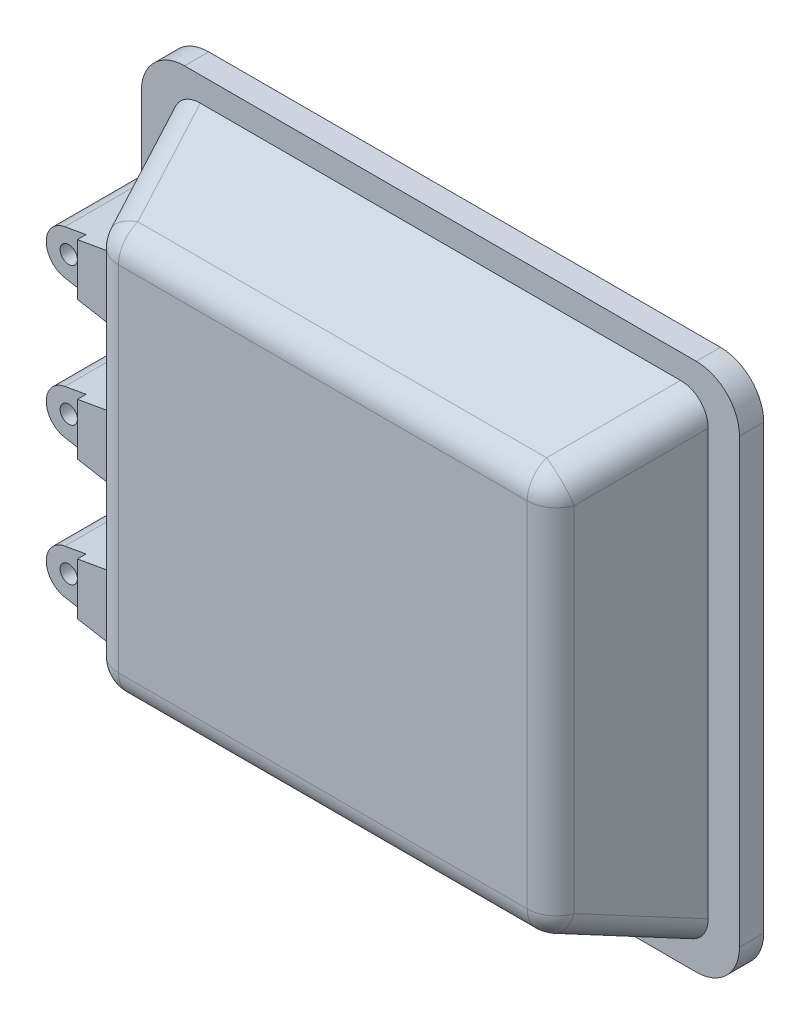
SolidWorks part; units mm, degrees
ref_plane "Ebene vorne" through (0, 0, 0) normal (0, 0, 1) x (1, 0, 0)
ref_plane "Ebene oben" through (0, 0, 0) normal (0, 1, 0) x (1, 0, 0)
ref_plane "Ebene rechts" through (0, 0, 0) normal (1, 0, 0) x (0, 0, -1)
sketch "Geometrieskizze" plane through (0, 0, 0) normal (0, 0, 1) x (1, 0, 0)
  line L0 (-145, 0) -> (145, 0) construction
  line L1 (-145, 129) -> (145, 129)
  line L2 (-145, 129) -> (-145, -129)
  line L3 (-145, -129) -> (145, -129)
  line L4 (145, 129) -> (145, -129)
  line L5 (0, 129) -> (0, -129) construction
  line L6 (-173, 153) -> (173, 153)
  line L7 (173, 153) -> (173, -153)
  line L8 (-173, -153) -> (173, -153)
  line L9 (-173, 153) -> (-173, -153)
  line L10 (0, 153) -> (0, 129) construction
  line L11 (145, 0) -> (173, 0) construction
  line L12 (0, -129) -> (0, -153) construction
  line L13 (-145, 0) -> (-173, 0) construction
  line L14 (-160, -142) -> (160, 142) construction
  line L15 (-160, 142) -> (160, 142) construction
  line L16 (-160, 142) -> (-160, -142) construction
  line L17 (-160, -142) -> (160, -142) construction
  line L18 (160, 142) -> (160, -142) construction
  point P8 (0, 0)
  point P22 (0, 0)
  dimension "D1" = 290
  dimension "D2" = 258
  dimension "D4" = 346
  dimension "D5" = 306
  dimension "D3" = 284
  dimension "D6" = 320
sketch "Skizze4" plane through (0, 0, 0) normal (0, 0, 1) x (1, 0, 0)
  line L4 (-145, 129) -> (145, 129) construction
  line L5 (145, 129) -> (145, -129) construction
  line L6 (-145, -129) -> (145, -129) construction
  line L7 (-145, 129) -> (-145, -129) construction
  line L8 (-145, 129) -> (145, 129)
  line L9 (145, 129) -> (145, -129)
  line L10 (-145, -129) -> (145, -129)
  line L11 (-145, 129) -> (-145, -129)
extrude "Innen_gerade" add sketch "Skizze4" along normal blind 6
sketch "Skizze5" plane through (0, 0, 6) normal (0, 0, 1) x (1, 0, 0)
  line L4 (-145, 129) -> (-145, -129)
  line L5 (145, 129) -> (-145, 129)
  line L6 (145, -129) -> (145, 129)
  line L7 (-145, -129) -> (145, -129)
  line L8 (-145, 129) -> (-145, -129)
  line L9 (145, 129) -> (-145, 129)
  line L10 (145, -129) -> (145, 129)
  line L11 (-145, -129) -> (145, -129)
  dimension "D1" = 0
extrude "Innen_Formschraege" add sketch "Skizze5" along normal blind 64 draft 20
fillet "Verrundung7" radius 5 8 edges at (-133.353, 117.353, 38) (-145, 129, 3) (133.353, 117.353, 38) (145, 129, 3) (133.353, -117.353, 38) (145, -129, 3) (-133.353, -117.353, 38) (-145, -129, 3)
fillet "Verrundung2" radius 5 8 edges at (120.3614, 104.3614, 70) (121.7059, 0, 70) (120.3614, -104.3614, 70) (0, -105.7059, 70) (-120.3614, -104.3614, 70) (-121.7059, 0, 70) (-120.3614, 104.3614, 70) (0, 105.7059, 70)
shell "Wandung1" thickness 12
sketch "Skizze6" plane through (0, 0, 0) normal (0, 0, 1) x (1, 0, 0)
  line L0 (-173, 153) -> (-173, -153) construction
  line L1 (-173, -153) -> (173, -153) construction
  line L2 (173, 153) -> (173, -153) construction
  line L3 (-173, 153) -> (173, 153) construction
  line L4 (-145, 129) -> (-145, -129) construction
  line L5 (-145, 129) -> (145, 129) construction
  line L6 (145, 129) -> (145, -129) construction
  line L7 (-145, -129) -> (145, -129) construction
  line L8 (-145, 129) -> (-145, -129)
  line L9 (-145, 129) -> (145, 129)
  line L10 (145, 129) -> (145, -129)
  line L11 (-145, -129) -> (145, -129)
  line L12 (0, -153) -> (0, -129) construction
  line L13 (-173, 153) -> (-173, -153)
  line L14 (-173, -153) -> (173, -153)
  line L15 (173, 153) -> (173, -153)
  line L16 (-173, 153) -> (173, 153)
  line L17 (-173, 0) -> (-145, 0) construction
  line L18 (0, 153) -> (0, 129) construction
  line L19 (145, 0) -> (173, 0) construction
extrude "Flansch" add sketch "Skizze6" along normal blind 14
fillet "Verrundung8" radius 25 4 edges at (-173, 153, 7) (173, 153, 7) (173, -153, 7) (-173, -153, 7)
sketch "Nocken" plane through (0, 0, 14) normal (0, 0, 1) x (1, 0, 0)
  line L0 (-115, 21.1353) -> (-162.2574, 12.8025)
  line L1 (-162.2574, -12.8025) -> (-115, -21.1353)
  line L2 (-160, 142) -> (-160, -142) construction
  line L3 (-160, 0) -> (-145, 0) construction
  line L4 (40.7, 0) -> (-40.7, 0) construction
  line L5 (-173, 153) -> (-173, -153) construction
  line L6 (-115, 21.1353) -> (-115, -21.1353)
  line L8 (-145, 129) -> (-145, -129) construction
  arc A0 (-162.2574, -12.8025) -> (-162.2574, 12.8025) centre (-160, 0) cw
  dimension "D1" = 13
  dimension "D2" = 10
  dimension "D3" = 30
extrude "Extrude1" add sketch "Nocken" along normal blind 60
other "DeleteFace1"
sketch "Sketch1" plane through (0, 0, 74) normal (0, 0, 1) x (1, 0, 0)
  line L0 (-150, 14.9638) -> (-150, -14.9638)
  line L1 (-162.2574, -12.8025) -> (-132.6271, -18.0271) construction
  line L2 (-132.6271, 18.0271) -> (-162.2574, 12.8025) construction
  line L3 (-162.2574, -12.8025) -> (-150, -14.9638)
  line L4 (-150, 14.9638) -> (-162.2574, 12.8025)
  arc A0 (-162.2574, 12.8025) -> (-162.2574, -12.8025) centre (-160, 0) ccw construction
  arc A1 (-162.2574, 12.8025) -> (-162.2574, -12.8025) centre (-160, 0) ccw
  dimension "D1" = 10
extrude "Cut-Extrude1" cut sketch "Sketch1" against normal blind 5
sketch "Sketch2" plane through (0, 0, 69) normal (0, 0, 1) x (1, 0, 0)
  circle A0 centre (-160, 0) radius 5
  dimension "D1" = 10
extrude "Cut-Extrude2" cut sketch "Sketch2" against normal up to next
pattern_linear "LPattern1" count 2 spacing 80 along (0, -1, 0) count 2 spacing 80 along (0, 1, 0) of "Extrude1", "DeleteFace1", "Cut-Extrude1", "Cut-Extrude2"
